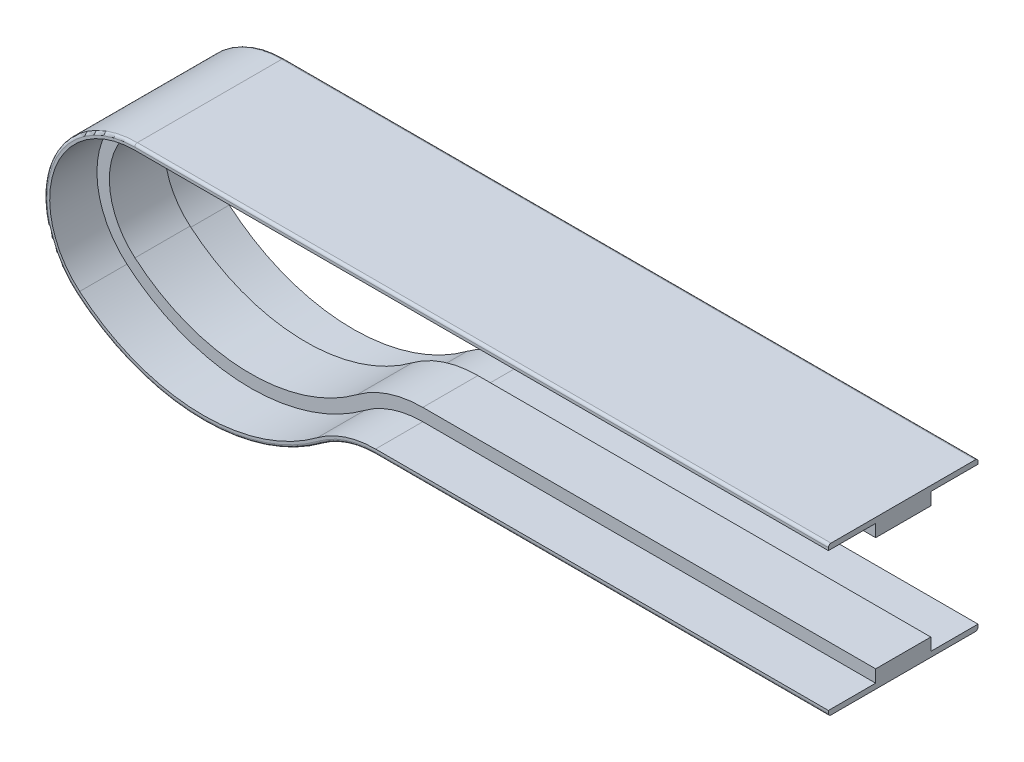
SolidWorks part; units mm, degrees
ref_plane "Plan de face" through (0, 0, 0) normal (0, 0, 1) x (1, 0, 0)
ref_plane "Plan de dessus" through (0, 0, 0) normal (0, 1, 0) x (1, 0, 0)
ref_plane "Plan de droite" through (0, 0, 0) normal (1, 0, 0) x (0, 0, -1)
sketch "Esquisse1" plane through (0, 0, 0) normal (0, 0, 1) x (1, 0, 0)
  line L1 (-530, 0) -> (0, 0)
  line L2 (0, -113.75) -> (-346, -113.75)
  arc A0 (-346, -113.75) -> (-388.0572, -127.6687) centre (-346, -184.25) ccw
  arc A1 (-530, 0) -> (-574.6877, -121.5738) centre (-530, -69) ccw
  arc A9 (-574.6877, -121.5738) -> (-388.0572, -127.6687) centre (-477.5405, -7.2829) ccw
  dimension "D1" = 138
  dimension "D2" = 530
  dimension "D3" = 113.75
  dimension "D4" = 184
  dimension "D5" = 70.5
  dimension "D6" = 150
sketch "Esquisse2" plane through (0, 0, 0) normal (1, 0, 0) x (0, 0, -1)
  line L0 (-55.15, 0) -> (55.15, 0)
  line L1 (-57.15, -2) -> (-57.15, -4)
  line L2 (-57.15, -4) -> (-21.05, -4)
  line L3 (-21.05, -4) -> (-21.05, -13.5)
  line L4 (-21.05, -13.5) -> (21.05, -13.5)
  line L5 (21.05, -13.5) -> (21.05, -4)
  line L6 (21.05, -4) -> (57.15, -4)
  line L7 (57.15, -4) -> (57.15, -2)
  arc A0 (-55.15, 0) -> (-57.15, -2) centre (-55.15, -2) ccw
  arc A1 (57.15, -2) -> (55.15, 0) centre (55.15, -2) ccw
  point P6 (0, 0)
  point P12 (-57.15, 0)
  point P15 (57.15, 0)
  dimension "D6" = 2
  dimension "D1" = 114.3
  dimension "D2" = 42.1
  dimension "D4" = 4
  dimension "D5" = 9.5
sweep "Balayage1" add profiles "Esquisse2" path "Esquisse1"
